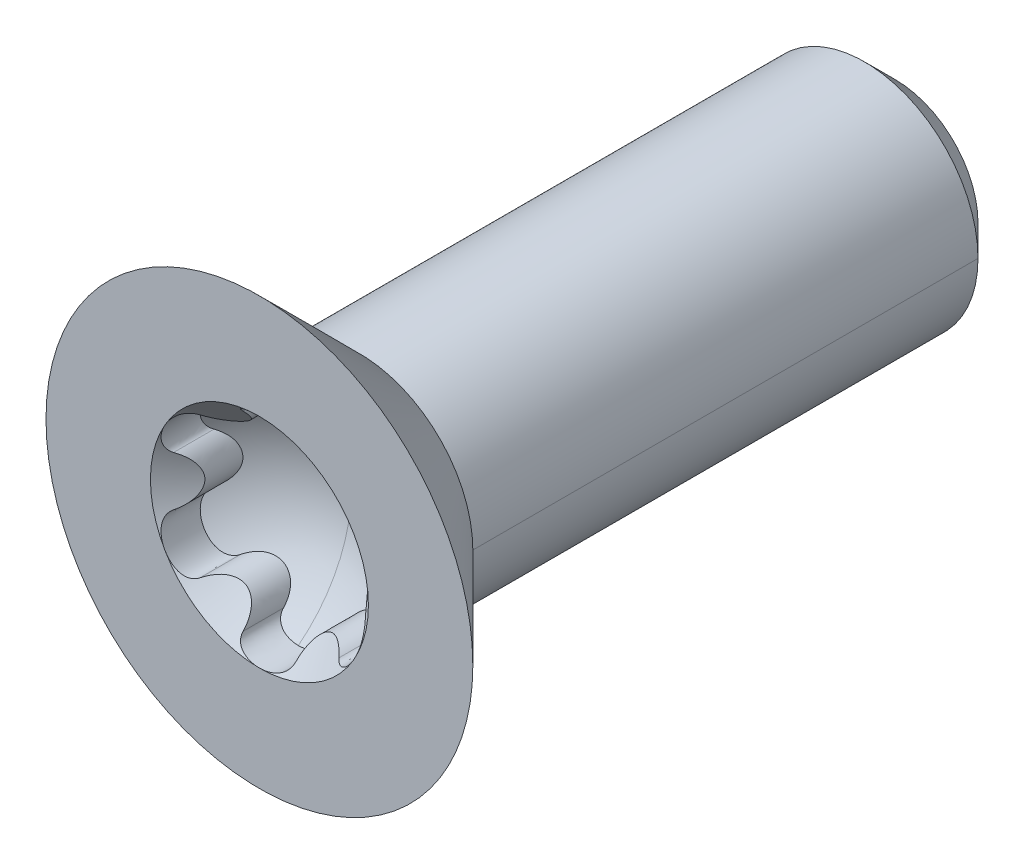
SolidWorks part; units mm, degrees
ref_plane "X_Y" through (0, 0, 0) normal (0, 0, 1) x (1, 0, 0)
ref_plane "Z_X" through (0, 0, 0) normal (0, 1, 0) x (1, 0, 0)
ref_plane "Y_Z" through (0, 0, 0) normal (1, 0, 0) x (0, 0, -1)
imported_body "Imported1"
other "Move Face1" parameters "D1"=1
